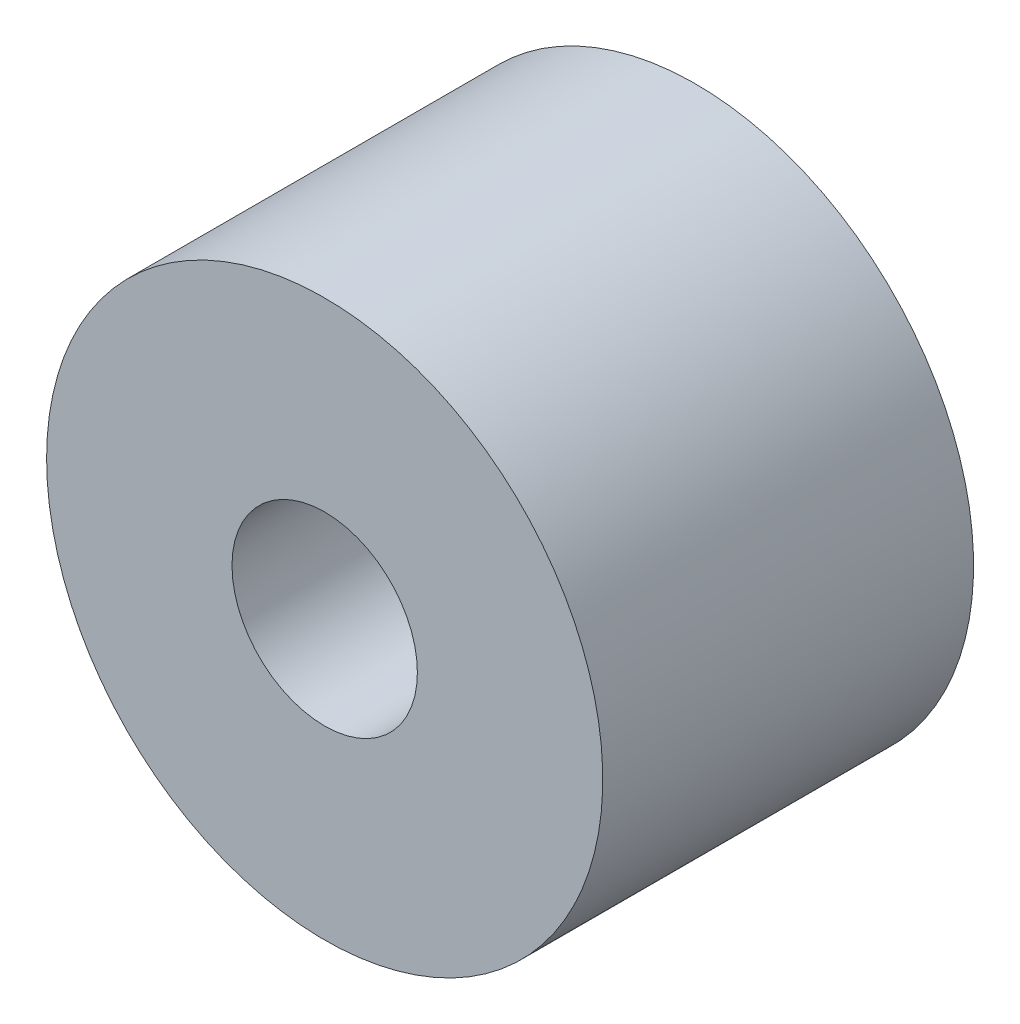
SolidWorks part; units mm, degrees
ref_plane "Front Plane" through (0, 0, 0) normal (0, 0, 1) x (1, 0, 0)
ref_plane "Top Plane" through (0, 0, 0) normal (0, 1, 0) x (1, 0, 0)
ref_plane "Right Plane" through (0, 0, 0) normal (1, 0, 0) x (0, 0, -1)
sketch "Sketch1" plane through (0, 0, 0) normal (1, 0, 0) x (0, 0, -1)
  line L0 (0, 55) -> (0, -55) construction
  line L1 (-3, -1.5) -> (3, -1.5)
  line L2 (-3, -1.5) -> (-3, -4.5)
  line L3 (-3, -4.5) -> (3, -4.5)
  line L4 (3, -1.5) -> (3, -4.5)
  line L5 (55, 0) -> (-55, 0) construction
  line L6 (0, 0) -> (-8.2563, 0) construction
  line L7 (0, 0) -> (7.3369, 0) construction
  point P11 (0, -1.5)
  dimension "D1" = 3
  dimension "D2" = 1.5
  dimension "D3" = 4.5
revolve "Revolve1" add sketch "Sketch1" angle 360 about L6
